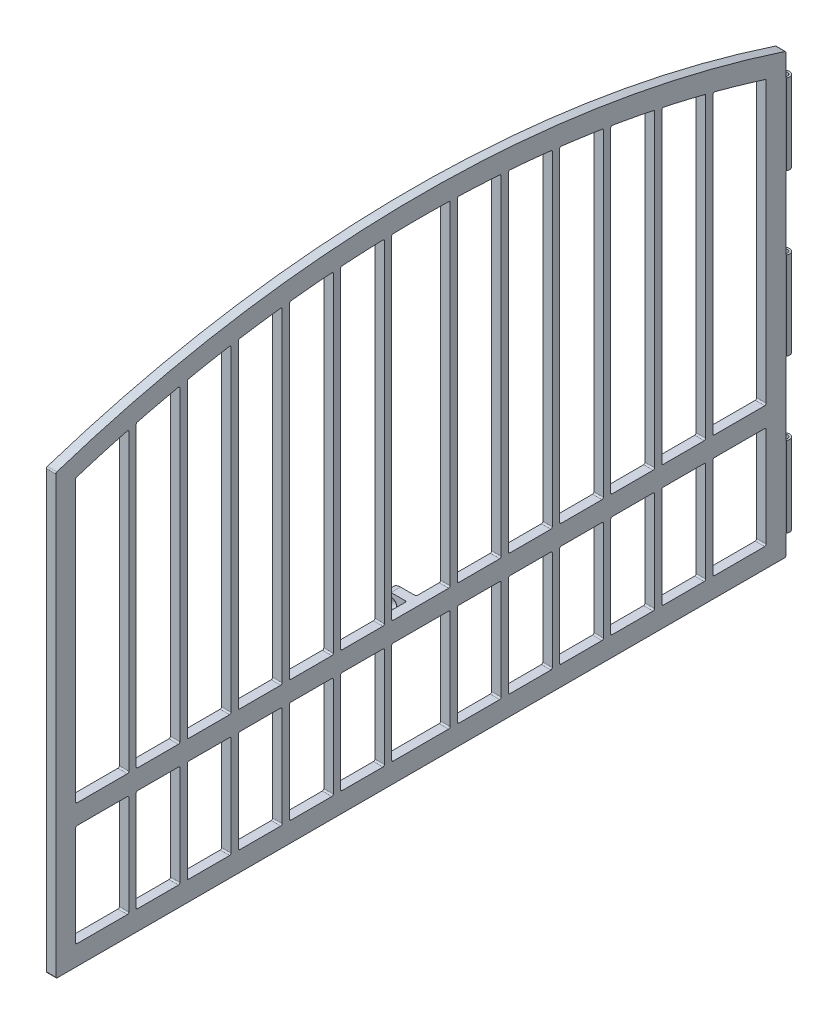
SolidWorks part; units mm, degrees
ref_plane "Front Plane" through (0, 0, 0) normal (0, 0, 1) x (1, 0, 0)
ref_plane "Top Plane" through (0, 0, 0) normal (0, 1, 0) x (1, 0, 0)
ref_plane "Right Plane" through (0, 0, 0) normal (1, 0, 0) x (0, 0, -1)
sketch "Sketch1" plane through (0, 0, 0) normal (0, 0, 1) x (1, 0, 0)
  line L0 (0, 8.5852) -> (0, -8.5852) construction
  line L9 (0, -8.5852) -> (13.6398, -8.5852)
  line L10 (13.6398, -8.5852) -> (13.6398, 8.5852)
  line L11 (13.6398, 8.5852) -> (0, 8.5852)
  arc A0 (0, 8.5852) -> (0, -8.5852) centre (0, 0) ccw
  circle A1 centre (0, 0) radius 4.1275
  dimension "D3" = 8.255
  dimension "D1" = 17.1704
  dimension "D2" = 22.225
extrude "Extrude1" add sketch "Sketch1" along normal mid plane 8.255
sketch "Sketch2" plane through (13.6398, 0, 0) normal (1, 0, 0) x (0, 0, -1)
  line L0 (-4.1275, 8.5852) -> (4.1275, 8.5852) construction
  line L1 (-300.3296, 8.5852) -> (-254, 8.5852)
  line L3 (-300.3296, -8.5852) -> (-254, -8.5852)
  line L4 (-300.3296, -97.4852) -> (-254, -97.4852)
  line L5 (-4.1275, -8.5852) -> (4.1275, -8.5852) construction
  line L6 (0, 0) -> (317.5, 0) construction
  line L7 (0, 0) -> (0, 348.3932) construction
  line L8 (-300.3296, -8.5852) -> (-300.3296, -97.4852)
  line L9 (-317.5, 266.3444) -> (-317.5, -114.6556)
  line L10 (-317.5, -114.6556) -> (317.5, -114.6556)
  line L11 (-300.3296, 253.8363) -> (-300.3296, 8.5852)
  line L12 (-25.4, 299.7345) -> (-25.4, 8.5852)
  line L13 (317.5, 266.3444) -> (317.5, -114.6556)
  line L14 (-31.75, 299.5528) -> (-31.75, 8.5852)
  line L16 (-69.85, 297.6122) -> (-69.85, 8.5852)
  line L17 (-76.2, 297.1467) -> (-76.2, 8.5852)
  line L18 (-114.3, 293.4961) -> (-114.3, 8.5852)
  line L19 (-120.65, 292.744) -> (-120.65, 8.5852)
  line L20 (-158.75, 287.3613) -> (-158.75, 8.5852)
  line L21 (-165.1, 286.3181) -> (-165.1, 8.5852)
  line L22 (203.2, -97.4852) -> (165.1, -97.4852)
  line L26 (-203.2, 279.1698) -> (-203.2, 8.5852)
  line L27 (-209.55, 277.8289) -> (-209.55, 8.5852)
  line L28 (-247.65, 268.8694) -> (-247.65, 8.5852)
  line L29 (-254, 267.222) -> (-254, 8.5852)
  line L31 (-69.85, 8.5852) -> (-31.75, 8.5852)
  line L32 (-114.3, 8.5852) -> (-76.2, 8.5852)
  line L33 (-158.75, 8.5852) -> (-120.65, 8.5852)
  line L34 (-203.2, 8.5852) -> (-165.1, 8.5852)
  line L35 (-247.65, 8.5852) -> (-209.55, 8.5852)
  line L36 (-25.4, -8.5852) -> (-25.4, -97.4852)
  line L37 (-31.75, -8.5852) -> (-31.75, -97.4852)
  line L38 (-69.85, -8.5852) -> (-69.85, -97.4852)
  line L39 (-76.2, -8.5852) -> (-76.2, -97.4852)
  line L40 (-114.3, -8.5852) -> (-114.3, -97.4852)
  line L41 (-120.65, -8.5852) -> (-120.65, -97.4852)
  line L42 (-158.75, -8.5852) -> (-158.75, -97.4852)
  line L43 (-165.1, -8.5852) -> (-165.1, -97.4852)
  line L44 (-203.2, -8.5852) -> (-203.2, -97.4852)
  line L45 (-158.75, -97.4852) -> (-120.65, -97.4852)
  line L46 (-247.65, -8.5852) -> (-247.65, -97.4852)
  line L47 (-254, -8.5852) -> (-254, -97.4852)
  line L48 (209.55, -8.5852) -> (209.55, -97.4852)
  line L49 (-69.85, -8.5852) -> (-31.75, -8.5852)
  line L50 (-114.3, -8.5852) -> (-76.2, -8.5852)
  line L51 (-158.75, -8.5852) -> (-120.65, -8.5852)
  line L52 (-203.2, -8.5852) -> (-165.1, -8.5852)
  line L53 (-247.65, -8.5852) -> (-209.55, -8.5852)
  line L54 (-247.65, -97.4852) -> (-209.55, -97.4852)
  line L55 (-114.3, -97.4852) -> (-76.2, -97.4852)
  line L56 (-69.85, -97.4852) -> (-31.75, -97.4852)
  line L57 (69.85, -97.4852) -> (31.75, -97.4852)
  line L58 (-209.55, -8.5852) -> (-209.55, -97.4852)
  line L59 (-203.2, -97.4852) -> (-165.1, -97.4852)
  line L60 (114.3, -97.4852) -> (76.2, -97.4852)
  line L61 (247.65, -97.4852) -> (209.55, -97.4852)
  line L62 (247.65, -8.5852) -> (209.55, -8.5852)
  line L63 (203.2, -8.5852) -> (165.1, -8.5852)
  line L64 (158.75, -8.5852) -> (120.65, -8.5852)
  line L65 (114.3, -8.5852) -> (76.2, -8.5852)
  line L66 (69.85, -8.5852) -> (31.75, -8.5852)
  line L67 (254, -8.5852) -> (254, -97.4852)
  line L68 (247.65, -8.5852) -> (247.65, -97.4852)
  line L69 (158.75, -97.4852) -> (120.65, -97.4852)
  line L70 (203.2, -8.5852) -> (203.2, -97.4852)
  line L71 (165.1, -8.5852) -> (165.1, -97.4852)
  line L72 (158.75, -8.5852) -> (158.75, -97.4852)
  line L73 (120.65, -8.5852) -> (120.65, -97.4852)
  line L74 (114.3, -8.5852) -> (114.3, -97.4852)
  line L75 (76.2, -8.5852) -> (76.2, -97.4852)
  line L76 (69.85, -8.5852) -> (69.85, -97.4852)
  line L77 (31.75, -8.5852) -> (31.75, -97.4852)
  line L78 (25.4, -8.5852) -> (25.4, -97.4852)
  line L79 (247.65, 8.5852) -> (209.55, 8.5852)
  line L80 (203.2, 8.5852) -> (165.1, 8.5852)
  line L81 (158.75, 8.5852) -> (120.65, 8.5852)
  line L82 (114.3, 8.5852) -> (76.2, 8.5852)
  line L83 (69.85, 8.5852) -> (31.75, 8.5852)
  line L84 (254, 267.222) -> (254, 8.5852)
  line L85 (247.65, 268.8694) -> (247.65, 8.5852)
  line L86 (209.55, 277.8289) -> (209.55, 8.5852)
  line L87 (203.2, 279.1698) -> (203.2, 8.5852)
  line L88 (165.1, 286.3181) -> (165.1, 8.5852)
  line L89 (158.75, 287.3613) -> (158.75, 8.5852)
  line L90 (120.65, 292.744) -> (120.65, 8.5852)
  line L91 (114.3, 293.4961) -> (114.3, 8.5852)
  line L92 (76.2, 297.1467) -> (76.2, 8.5852)
  line L93 (69.85, 297.6122) -> (69.85, 8.5852)
  line L94 (31.75, 299.5528) -> (31.75, 8.5852)
  line L95 (25.4, 299.7345) -> (25.4, 8.5852)
  line L96 (300.3296, 253.8363) -> (300.3296, 8.5852)
  line L97 (300.3296, -8.5852) -> (300.3296, -97.4852)
  line L98 (254, -8.5852) -> (300.3296, -8.5852)
  line L99 (254, -97.4852) -> (300.3296, -97.4852)
  line L100 (300.3296, 8.5852) -> (254, 8.5852)
  line L101 (-25.4, 8.5852) -> (25.4, 8.5852)
  line L102 (-25.4, -8.5852) -> (25.4, -8.5852)
  line L103 (-25.4, -97.4852) -> (25.4, -97.4852)
  arc A0 (-317.5, 266.3444) -> (317.5, 266.3444) centre (0, -698.772) cw
  arc A1 (-300.3296, 253.8363) -> (-254, 267.222) centre (0, -698.772) cw
  arc A2 (-247.65, 268.8694) -> (-209.55, 277.8289) centre (0, -698.772) cw
  arc A3 (-203.2, 279.1698) -> (-165.1, 286.3181) centre (0, -698.772) cw
  arc A4 (-158.75, 287.3613) -> (-120.65, 292.744) centre (0, -698.772) cw
  arc A5 (-114.3, 293.4961) -> (-76.2, 297.1467) centre (0, -698.772) cw
  arc A6 (-69.85, 297.6122) -> (-31.75, 299.5528) centre (0, -698.772) cw
  arc A7 (69.85, 297.6122) -> (31.75, 299.5528) centre (0, -698.772) ccw
  arc A8 (114.3, 293.4961) -> (76.2, 297.1467) centre (0, -698.772) ccw
  arc A9 (158.75, 287.3613) -> (120.65, 292.744) centre (0, -698.772) ccw
  arc A10 (203.2, 279.1698) -> (165.1, 286.3181) centre (0, -698.772) ccw
  arc A11 (247.65, 268.8694) -> (209.55, 277.8289) centre (0, -698.772) ccw
  arc A12 (300.3296, 253.8363) -> (254, 267.222) centre (0, -698.772) ccw
  arc A13 (25.4, 299.7345) -> (-25.4, 299.7345) centre (0, -698.772) ccw
  dimension "D6" = 1016
  dimension "D1" = 17.1704
  dimension "D2" = 6.35
  dimension "D3" = 635
  dimension "D4" = 17.1704
  dimension "D5" = 381
  dimension "D7" = 88.9
  dimension "D8" = 17.1704
  dimension "D9" = 25.4
  dimension "D10" = 46.3296
  dimension "D11" = 6.35
  dimension "D12" = 6.35
  dimension "D13" = 38.1
  dimension "D14" = 38.1
extrude "Extrude2" add sketch "Sketch2" along normal blind 8.255
fillet "Fillet2" radius 1.27 112 edges at (13.6398, 0, 4.1275) (4.1275, 0, -4.1275) (13.6398, 0, -4.1275) (17.7673, 266.3444, -317.5) (17.7673, -114.6556, -317.5) (17.7673, -114.6556, 317.5) (17.7673, 266.3444, 317.5) (17.7673, 8.5852, 203.2) (17.7673, 8.5852, 247.65) (17.7673, 8.5852, 300.3296) (17.7673, -97.4852, 300.3296) (17.7673, -97.4852, 247.65) (17.7673, -97.4852, 203.2) (17.7673, -97.4852, 158.75) (17.7673, -97.4852, 114.3) (17.7673, -97.4852, 69.85) (17.7673, -97.4852, 25.4) (17.7673, -97.4852, -31.75) (17.7673, -97.4852, -76.2) (17.7673, -97.4852, -120.65) (17.7673, -97.4852, -165.1) (17.7673, -97.4852, -209.55) (17.7673, -97.4852, -254) (17.7673, 8.5852, 158.75) (17.7673, 8.5852, 114.3) (17.7673, 8.5852, 69.85) (17.7673, 8.5852, 25.4) (17.7673, 8.5852, -31.75) (17.7673, 8.5852, -76.2) (17.7673, 8.5852, -120.65) (17.7673, 8.5852, -165.1) (17.7673, 8.5852, -209.55) (17.7673, 8.5852, -254) (17.7673, -97.4852, -300.3296) (17.7673, -97.4852, -247.65) (17.7673, -97.4852, -203.2) (17.7673, -97.4852, -158.75) (17.7673, -97.4852, -114.3) (17.7673, -97.4852, -69.85) (17.7673, -97.4852, -25.4) (17.7673, -97.4852, 31.75) (17.7673, -97.4852, 76.2) (17.7673, -97.4852, 120.65) (17.7673, -97.4852, 165.1) (17.7673, -97.4852, 209.55) (17.7673, -97.4852, 254) (17.7673, 8.5852, 254) (17.7673, 8.5852, 209.55) (17.7673, 8.5852, 165.1) (17.7673, 8.5852, 120.65) (17.7673, 8.5852, 76.2) (17.7673, 8.5852, 31.75) (17.7673, 8.5852, -25.4) (17.7673, 8.5852, -69.85) (17.7673, 8.5852, -114.3) (17.7673, 8.5852, -158.75) (17.7673, 8.5852, -203.2) (17.7673, 8.5852, -247.65) (17.7673, 8.5852, -300.3296) (17.7673, 299.7345, 25.4) (17.7673, 299.5528, -31.75) (17.7673, 297.1467, -76.2) (17.7673, 292.744, -120.65) (17.7673, 286.3181, -165.1) (17.7673, 277.8289, -209.55) (17.7673, 267.222, -254) (17.7673, -8.5852, -254) (17.7673, -8.5852, -209.55) (17.7673, -8.5852, -165.1) (17.7673, -8.5852, -120.65) (17.7673, -8.5852, -76.2) (17.7673, -8.5852, -31.75) (17.7673, -8.5852, 25.4) (17.7673, -8.5852, 69.85) (17.7673, -8.5852, 114.3) (17.7673, -8.5852, 158.75) (17.7673, 297.6122, 69.85) (17.7673, 293.4961, 114.3) (17.7673, 287.3613, 158.75) (17.7673, 279.1698, 203.2) (17.7673, 268.8694, 247.65) (17.7673, -8.5852, 203.2) (17.7673, -8.5852, 247.65) (17.7673, 253.8363, 300.3296) (17.7673, -8.5852, 300.3296) (17.7673, -8.5852, 254) (17.7673, -8.5852, 209.55) (17.7673, -8.5852, 165.1) (17.7673, -8.5852, 120.65) (17.7673, -8.5852, 76.2) (17.7673, -8.5852, 31.75) (17.7673, -8.5852, -25.4) (17.7673, -8.5852, -69.85) (17.7673, -8.5852, -114.3) (17.7673, -8.5852, -158.75) (17.7673, -8.5852, -203.2) (17.7673, -8.5852, -247.65) (17.7673, -8.5852, -300.3296) (17.7673, 253.8363, -300.3296) (17.7673, 268.8694, -247.65) (17.7673, 279.1698, -203.2) (17.7673, 287.3613, -158.75) (17.7673, 293.4961, -114.3) (17.7673, 297.6122, -69.85) (17.7673, 299.7345, -25.4) (17.7673, 299.5528, 31.75) (17.7673, 297.1467, 76.2) (17.7673, 292.744, 120.65) (17.7673, 286.3181, 165.1) (17.7673, 277.8289, 209.55) (17.7673, 267.222, 254) (4.1275, 0, 4.1275)
sketch "Sketch3" plane through (0, -97.4852, 0) normal (0, 1, 0) x (-1, 0, 0)
  line L0 (-21.8948, -316.6258) -> (-13.6398, -316.6258) construction
  line L1 (-13.6398, -317.5) -> (-21.8948, -317.5) construction
  line L2 (-15.2271, -317.5) -> (-20.3075, -317.5)
  line L3 (-21.8948, 316.6258) -> (-21.8948, -316.6258) construction
  arc A0 (-20.3075, -317.5) -> (-15.2271, -317.5) centre (-17.7673, -320.7533) ccw
  circle A1 centre (-17.7673, -320.7533) radius 2.54
  dimension "D1" = 8.255
  dimension "D2" = 5.08
extrude "Extrude3" add sketch "Sketch3" along normal blind 342.9
sketch "Sketch4" plane through (13.6398, 0, 0) normal (-1, 0, 0) x (0, 0, 1)
  line L0 (-317.5, -113.3856) -> (-317.5, 265.4248) construction
  line L1 (-317.5, 175.5648) -> (-324.8808, 175.5648)
  line L2 (-317.5, 175.5648) -> (-317.5, 112.0648)
  line L3 (-317.5, 112.0648) -> (-324.8808, 112.0648)
  line L4 (-324.8808, 175.5648) -> (-324.8808, 112.0648)
  line L5 (-324.8808, 245.4148) -> (-324.8808, -97.4852) construction
  line L6 (-324.8808, 73.9648) -> (-230.397, 73.9648) construction
  line L7 (-324.8808, -27.6352) -> (-324.8808, 35.8648)
  line L8 (-317.5, 35.8648) -> (-324.8808, 35.8648)
  line L9 (-317.5, -27.6352) -> (-317.5, 35.8648)
  line L10 (-317.5, -27.6352) -> (-324.8808, -27.6352)
  line L11 (-317.5, 245.4148) -> (-324.8808, 245.4148) construction
  dimension "D1" = 63.5
  dimension "D2" = 69.85
extrude "Cut-Extrude1" cut sketch "Sketch4" against normal through all
fillet "Fillet3" radius 0.8128 6 edges at (15.2271, -62.5602, -317.5) (20.3075, -62.5602, -317.5) (15.2271, 73.9648, -317.5) (20.3075, 73.9648, -317.5) (20.3075, 210.4898, -317.5) (15.2271, 210.4898, -317.5)
